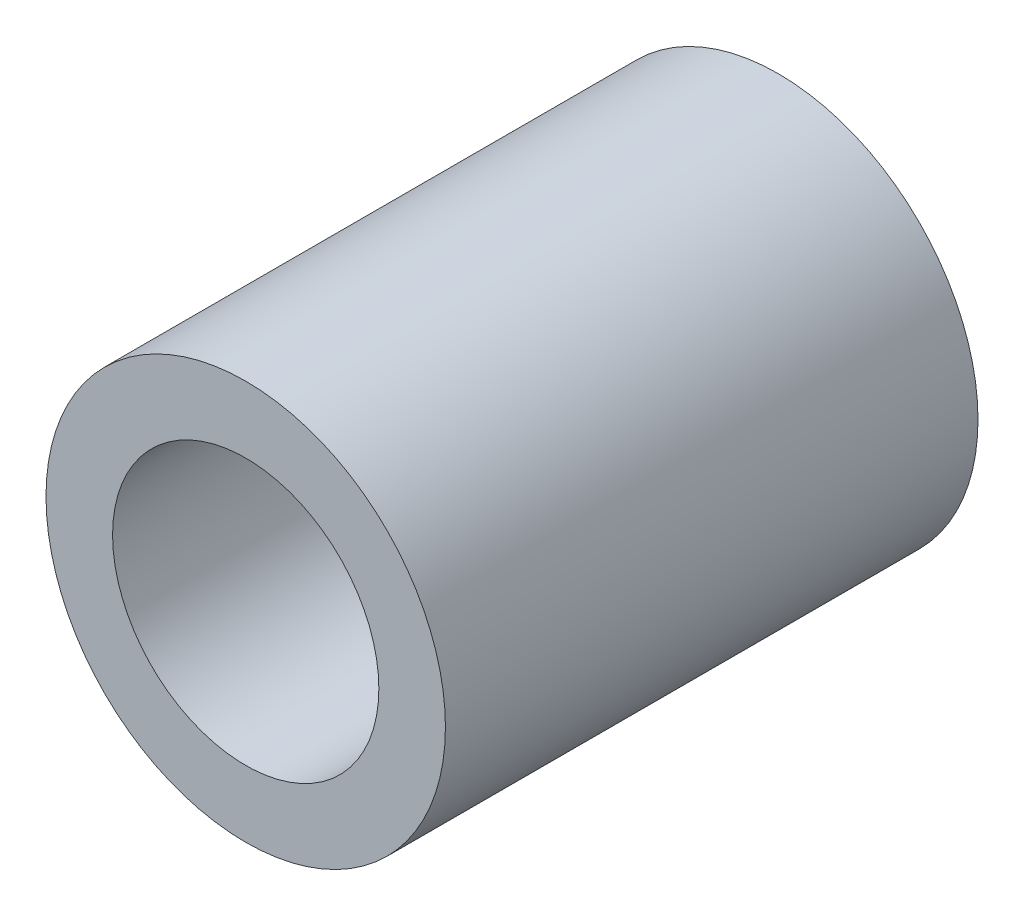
SolidWorks part; units mm, degrees
ref_plane "Front Plane" through (0, 0, 0) normal (0, 0, 1) x (1, 0, 0)
ref_plane "Top Plane" through (0, 0, 0) normal (0, 1, 0) x (1, 0, 0)
ref_plane "Right Plane" through (0, 0, 0) normal (1, 0, 0) x (0, 0, -1)
sketch "Sketch1" plane through (0, 0, 0) normal (0, 0, 1) x (1, 0, 0)
  circle A0 centre (0, 0) radius 15
  dimension "D1" = 30
extrude "Extrude1" add sketch "Sketch1" along normal mid plane 40
sketch "Sketch2" plane through (0, 0, 20) normal (0, 0, 1) x (1, 0, 0)
  circle A0 centre (0, 0) radius 10
  dimension "D1" = 20
extrude "Cut-Extrude1" cut sketch "Sketch2" against normal through all
